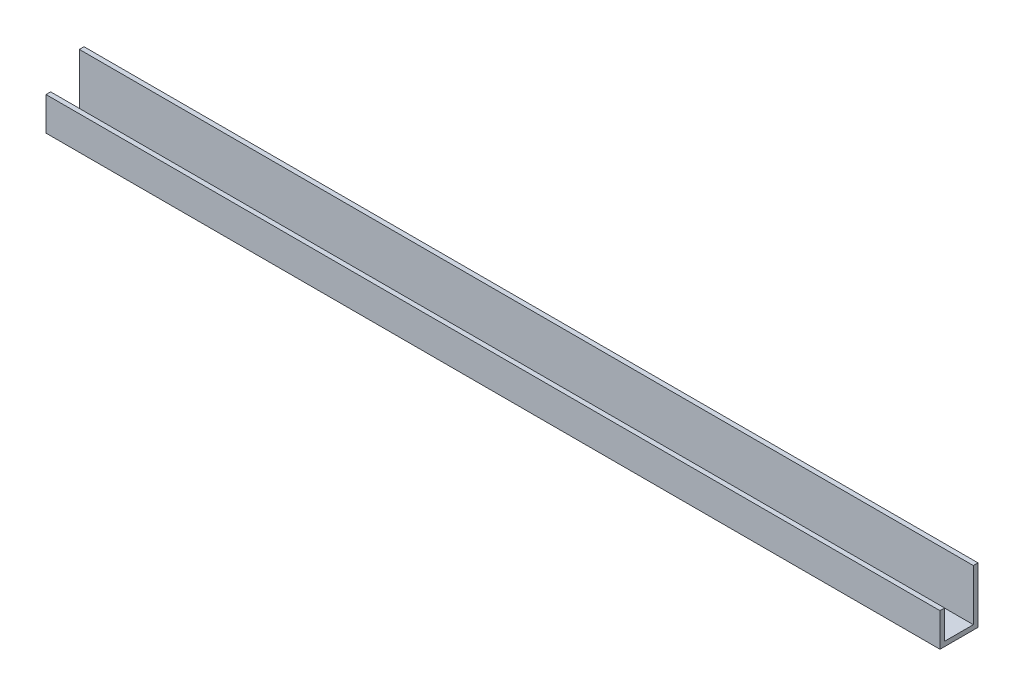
SolidWorks part; units mm, degrees
ref_plane "Front Plane" through (0, 0, 0) normal (0, 0, 1) x (1, 0, 0)
ref_plane "Top Plane" through (0, 0, 0) normal (0, 1, 0) x (1, 0, 0)
ref_plane "Right Plane" through (0, 0, 0) normal (1, 0, 0) x (0, 0, -1)
sketch "Sketch1" plane through (0, 0, 0) normal (0, 1, 0) x (1, 0, 0)
  line L1 (0, 0) -> (304.8, 0)
  line L2 (0, 0) -> (0, -12.954)
  line L3 (0, -12.954) -> (304.8, -12.954)
  line L4 (304.8, 0) -> (304.8, -12.954)
  dimension "D1" = 304.8
  dimension "D2" = 12.954
extrude "Boss-Extrude1" add sketch "Sketch1" along normal blind 19.05
sketch "Sketch2" plane through (0, 19.05, 0) normal (0, 1, 0) x (1, 0, 0)
  line L0 (0, 0) -> (0, -12.954) construction
  line L1 (0, -1.5875) -> (304.8, -1.5875)
  line L2 (0, -1.5875) -> (0, -11.3665)
  line L3 (0, -11.3665) -> (304.8, -11.3665)
  line L4 (304.8, -1.5875) -> (304.8, -11.3665)
  line L5 (304.8, -12.954) -> (304.8, 0) construction
  line L6 (304.8, 0) -> (0, 0) construction
  line L7 (0, -12.954) -> (304.8, -12.954) construction
  dimension "D1" = 1.5875
  dimension "D2" = 1.5875
extrude "Cut-Extrude1" cut sketch "Sketch2" against normal blind 17.4625
sketch "Sketch3" plane through (0, 0, 12.954) normal (0, 0, 1) x (1, 0, 0)
  line L0 (304.8, 19.05) -> (304.8, 0) construction
  line L1 (0, 19.05) -> (304.8, 19.05)
  line L2 (0, 19.05) -> (0, 11.4046)
  line L3 (0, 11.4046) -> (304.8, 11.4046)
  line L4 (304.8, 19.05) -> (304.8, 11.4046)
  dimension "D1" = 7.6454
extrude "Cut-Extrude2" cut sketch "Sketch3" against normal up to next
